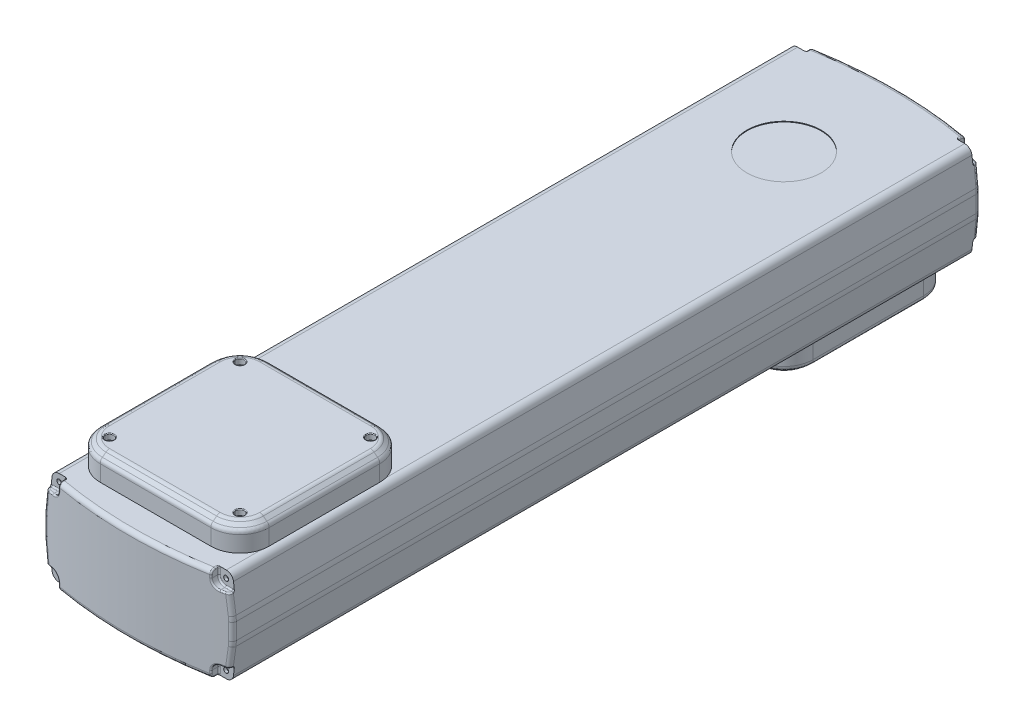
SolidWorks part; units mm, degrees
ref_plane "前视基准面" through (0, 0, 0) normal (0, 0, 1) x (1, 0, 0)
ref_plane "上视基准面" through (0, 0, 0) normal (0, 1, 0) x (1, 0, 0)
ref_plane "右视基准面" through (0, 0, 0) normal (1, 0, 0) x (0, 0, -1)
imported_body "MB10SC-700.sldasm-Part-1-1-solid1"
imported_body "MB10SC-700.sldasm-Part-2-1-solid1"
imported_body "MB10SC-700.sldasm-Part-3-1-solid1"
imported_body "MB10SC-700.sldasm-Part-4-1-solid1"
imported_body "MB10SC-700.sldasm-Part-5-1-solid1"
imported_body "MB10SC-700.sldasm-Part-6-1-solid1"
imported_body "MB10SC-700.sldasm-Part-7-1-solid1"
imported_body "MB10SC-700.sldasm-Part-8-1-solid1"
imported_body "MB10SC-700.sldasm-Part-9-1-surface1"
imported_body "MB10SC-700.sldasm-Part-9-1-surface2"
imported_body "MB10SC-700.sldasm-Part-9-1-surface3"
imported_body "MB10SC-700.sldasm-Part-9-1-surface4"
imported_body "MB10SC-700.sldasm-Part-9-1-surface5"
imported_body "MB10SC-700.sldasm-Part-9-1-surface6"
imported_body "MB10SC-700.sldasm-Part-9-1-surface7"
imported_body "MB10SC-700.sldasm-Part-9-1-surface8"
imported_body "MB10SC-700.sldasm-Part-9-1-surface9"
imported_body "MB10SC-700.sldasm-Part-9-1-surface10"
imported_body "MB10SC-700.sldasm-Part-9-1-surface11"
imported_body "MB10SC-700.sldasm-Part-9-1-surface12"
imported_body "MB10SC-700.sldasm-Part-9-1-surface13"
imported_body "MB10SC-700.sldasm-Part-9-1-surface14"
imported_body "MB10SC-700.sldasm-Part-10-1-solid1"
delete or keep bodies "实体-删除/保留 1" type keep bodies bodies 113
sketch "草图1" plane through (0, 162.3, 0) normal (0, -1, 0) x (1, 0, 0)
  circle A0 centre (0, 0) radius 26.3803
extrude "切除-拉伸1" cut sketch "草图1" against normal blind 0.5
sketch "草图4" plane through (0, 227.3, 0) normal (0, 1, 0) x (1, 0, 0)
  circle A0 centre (0, 375) radius 25.5941
extrude "切除-拉伸2" cut sketch "草图4" against normal blind 0.5
